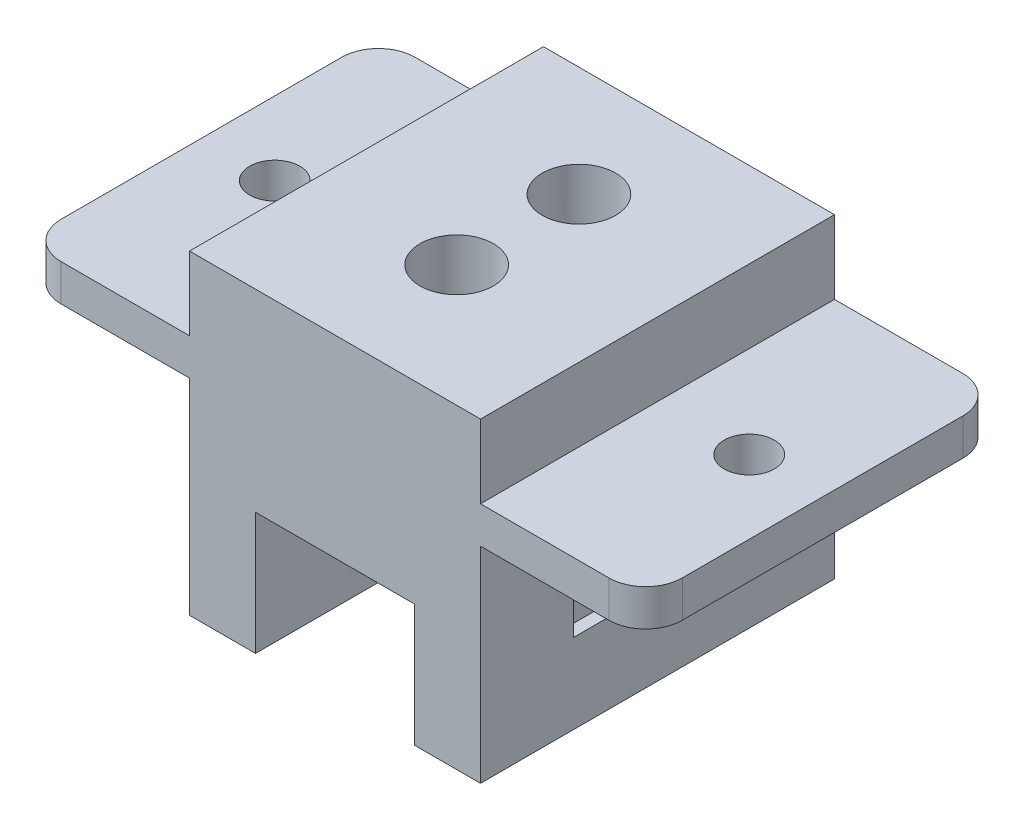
SolidWorks part; units mm, degrees
ref_plane "Front Plane" through (0, 0, 0) normal (0, 0, 1) x (1, 0, 0)
ref_plane "Top Plane" through (0, 0, 0) normal (0, 1, 0) x (1, 0, 0)
ref_plane "Right Plane" through (0, 0, 0) normal (1, 0, 0) x (0, 0, -1)
sketch "Sketch1" plane through (0, 0, 0) normal (0, 0, 1) x (1, 0, 0)
  line L0 (0, 0) -> (0, 25.8)
  line L1 (0, 25.8) -> (23.8, 25.8)
  line L2 (23.8, 25.8) -> (23.8, 0)
  line L3 (23.8, 0) -> (18.4, 0)
  line L4 (18.4, 0) -> (18.4, 10)
  line L5 (18.4, 10) -> (5.4, 10)
  line L6 (5.4, 10) -> (5.4, 0)
  line L7 (5.4, 0) -> (0, 0)
  line L8 (0, 20) -> (23.8, 20) construction
  dimension "D1" = 13
  dimension "D2" = 10
  dimension "D3" = 23.8
  dimension "D4" = 20
  dimension "D5" = 5.8
extrude "Boss-Extrude1" add sketch "Sketch1" along normal blind 28.95 contours L1 L2 L3 L4 L5 L6 L7 L0
sketch "Sketch2" plane through (0, 25.8, 0) normal (0, 1, 0) x (1, 0, 0)
  line L0 (0, 0) -> (23.8, 0) construction
  circle A0 centre (11.9, -9) radius 3
  circle A1 centre (11.9, -19) radius 3
  point P0 (11.9, 0)
  point P7 (11.9, -6)
  point P10 (11.9, -22)
  dimension "D3" = 6
  dimension "D1" = 6
  dimension "D2" = 10
extrude "Cut-Extrude1" cut sketch "Sketch2" against normal blind 28
ref_plane "Plane4" through (0, 19.8, 0) normal (0, 1, 0) x (1, 0, 0)
sketch "Sketch3" plane through (0, 19.8, 0) normal (0, 1, 0) x (1, 0, 0)
  line L0 (0, 0) -> (-10.5, 0)
  line L1 (-13.5, -3) -> (-13.5, -25.95)
  line L2 (-10.5, -28.95) -> (0, -28.95)
  line L3 (0, -28.95) -> (0, 0) construction
  line L4 (11.9, -9) -> (11.9, -19) construction
  line L5 (34.3, -28.95) -> (23.8, -28.95)
  line L6 (37.3, -3) -> (37.3, -25.95)
  line L7 (23.8, 0) -> (34.3, 0)
  line L8 (0, 0) -> (0, -28.95)
  line L9 (23.8, 0) -> (23.8, -28.95)
  circle A0 centre (-7.5, -14.475) radius 2.05
  arc A1 (-13.5, -25.95) -> (-10.5, -28.95) centre (-10.5, -25.95) ccw
  arc A2 (-10.5, 0) -> (-13.5, -3) centre (-10.5, -3) ccw
  arc A3 (34.3, 0) -> (37.3, -3) centre (34.3, -3) cw
  arc A4 (37.3, -25.95) -> (34.3, -28.95) centre (34.3, -25.95) cw
  circle A5 centre (31.3, -14.475) radius 2.05
  point P11 (-13.5, -14.475)
  point P15 (-13.5, 0)
  point P30 (37.3, 0)
  point P31 (37.3, -14.475)
  dimension "D3" = 4.1
  dimension "D4" = 3
  dimension "D1" = 13.5
  dimension "D2" = 7.5
extrude "Boss-Extrude2" add sketch "Sketch3" against normal blind 3
sketch "Sketch4" plane through (0, 0, 0) normal (-1, 0, 0) x (0, 0, 1)
  line L0 (11.4589, 11.9688) -> (11.4589, 14.6009)
  line L1 (21.3382, 6.5301) -> (11.4589, 6.5301)
  line L2 (21.3382, 6.5301) -> (21.3382, 11.9688)
  line L3 (21.3382, 11.9688) -> (11.4589, 11.9688)
  line L5 (11.4589, 14.6009) -> (6.8489, 9.2495)
  line L6 (6.8489, 9.2495) -> (11.4589, 3.8981)
  line L7 (11.4589, 3.8981) -> (11.4589, 6.5301)
  point P7 (21.3382, 9.2495)
  point P8 (0, 0)
  point P9 (10.4209, 11.9688)
  point P10 (11.4589, 14.6009)
extrude "Cut-Extrude2" cut sketch "Sketch4" against normal blind 1
ref_plane "Plane5" through (11.9, 0, 0) normal (1, 0, 0) x (0, 0, -1)
mirror "Mirror1" about plane through (11.9, 0, 0) normal (1, 0, 0) of "Cut-Extrude2"
equation "\"t\"= 0.25in"
